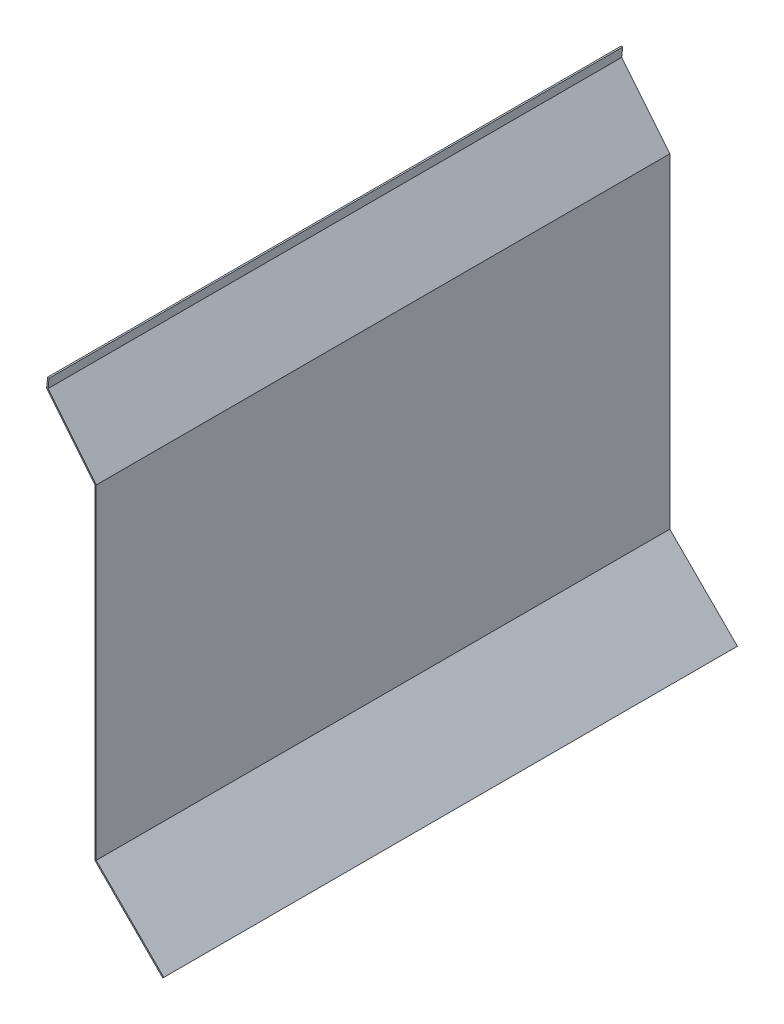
SolidWorks part; units mm, degrees
ref_plane "Face" through (0, 0, 0) normal (0, 0, 1) x (1, 0, 0)
ref_plane "Dessus" through (0, 0, 0) normal (0, 1, 0) x (1, 0, 0)
ref_plane "Droite" through (0, 0, 0) normal (1, 0, 0) x (0, 0, -1)
sketch "Esquisse2" plane through (0, 0, 0) normal (0, 0, 1) x (1, 0, 0)
  line L0 (-3670.6731, 3490.4516) -> (-3669.1813, 3490.2948)
  line L1 (-3669.1813, 3490.2948) -> (-3670.2266, 3480.3496)
  line L2 (-3670.2266, 3480.3496) -> (-3619.881, 3418.1779)
  line L3 (-3670.6731, 3490.4516) -> (-3671.7833, 3479.8885)
  line L4 (-3671.7833, 3479.8885) -> (-3621.381, 3417.6468)
  line L5 (-3619.881, 3418.1779) -> (-3619.881, 3078.1779)
  line L6 (-3621.381, 3417.6468) -> (-3621.381, 3077.5566)
  line L7 (-3621.381, 3077.5566) -> (-3550.231, 3006.4066)
  line L8 (-3550.231, 3006.4066) -> (-3549.1703, 3007.4673)
  line L9 (-3549.1703, 3007.4673) -> (-3619.881, 3078.1779)
extrude "Base-Extrusion" add sketch "Esquisse2" along normal blind 600
